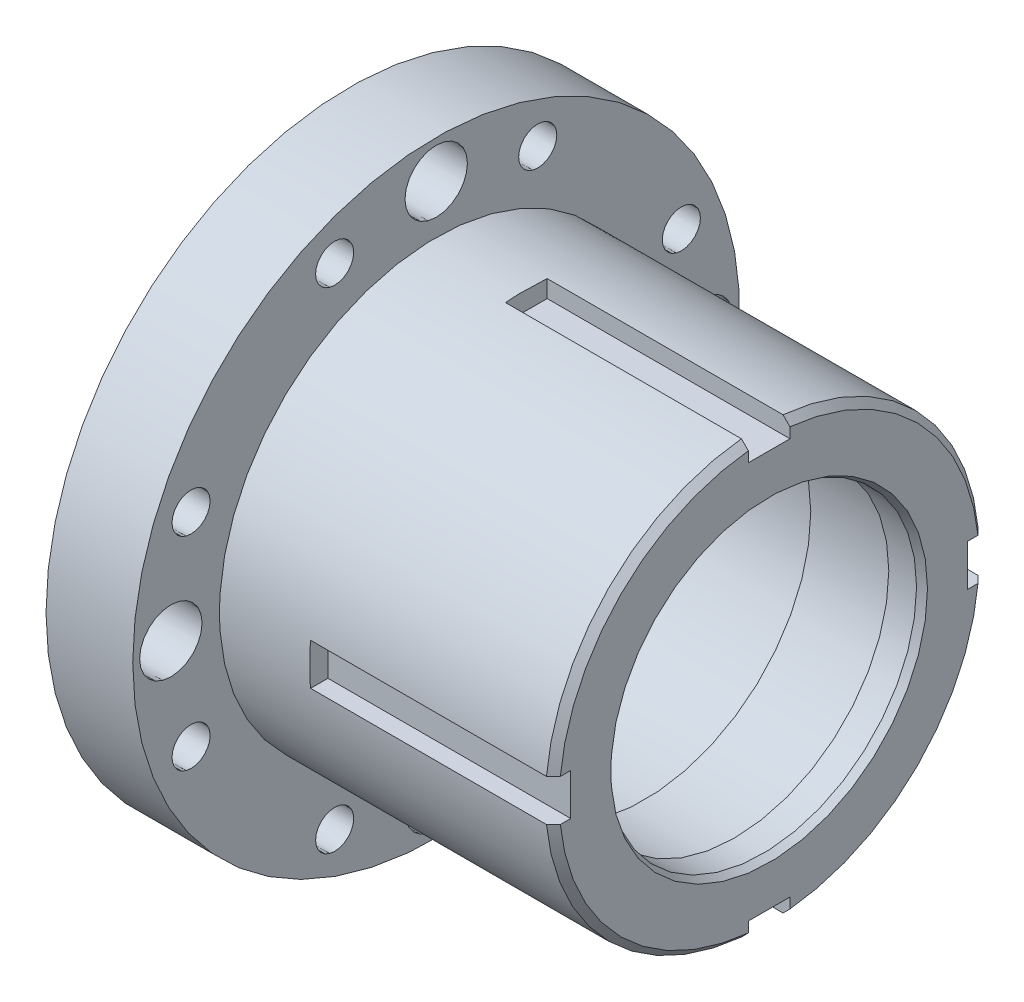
SolidWorks part; units mm, degrees
ref_plane "Plan de face" through (0, 0, 0) normal (0, 0, 1) x (1, 0, 0)
ref_plane "Plan de dessus" through (0, 0, 0) normal (0, 1, 0) x (1, 0, 0)
ref_plane "Plan de droite" through (0, 0, 0) normal (1, 0, 0) x (0, 0, -1)
sketch "Esquisse1" plane through (0, 0, 0) normal (0, 0, 1) x (1, 0, 0)
  line L0 (0, 61.7998) -> (0, 51.5)
  line L1 (1.5, 50) -> (56, 50)
  line L2 (56, 50) -> (56, 48)
  line L3 (25, 62.4996) -> (118.9998, 62.4996)
  line L4 (56, 48) -> (110.9998, 48)
  line L14 (0, 51.5) -> (1.5, 50)
  line L18 (0, 87.4999) -> (25, 87.4999)
  line L19 (2.3, 65.6998) -> (2.3, 61.7998)
  line L20 (2.3, 65.6998) -> (0, 65.6998)
  line L21 (2.3, 61.7998) -> (0, 61.7998)
  line L22 (25, 87.4999) -> (25, 62.4996)
  line L28 (120.9998, 60.4996) -> (120.9998, 45.6543)
  line L29 (110.9998, 44.4996) -> (110.9998, 48)
  line L30 (118.9998, 44.4996) -> (110.9998, 44.4996)
  line L31 (118.9998, 44.4996) -> (120.9998, 45.6543)
  line L32 (118.9998, 62.4996) -> (120.9998, 60.4996)
  line L33 (0, 87.4999) -> (0, 65.6998)
  line L42 (-102.5038, 0) -> (250.4656, 0) construction
  dimension "D1" = 54.5
  dimension "D2" = 50
revolve "Révolution1" add sketch "Esquisse1" angle 360 about L42
sketch "Esquisse3" plane through (0, 0, 0) normal (-1, 0, 0) x (0, 0, 1)
  line L0 (0, 95.6859) -> (0, 0) construction
  line L1 (0, 0) -> (-40.0963, 96.8011) construction
  line L2 (0.001, 0) -> (-29.2753, 70.6768) construction
  line L3 (0.001, 0) -> (29.2756, 70.6775) construction
  circle A0 centre (0, 0) radius 76.5 construction
  circle A1 centre (-29.2753, 70.6768) radius 5.5
  circle A2 centre (29.2756, 70.6775) radius 5.5
  dimension "D2" = 153
  dimension "D3" = 11
  dimension "D1" = 22.5
  dimension "D4" = 45
extrude "Extrusion2" cut sketch "Esquisse3" against normal blind 35
pattern_circular "Répétition circulaire1" count 4 over 360 about axis through (0, 0, 0) along (1, 0, 0) of "Extrusion2"
sketch "Esquisse4" plane through (0, 0, 0) normal (-1, 0, 0) x (0, 0, 1)
  line L0 (0, 100.9225) -> (0, 0) construction
  circle A0 centre (0, 0) radius 76.5 construction
  circle A1 centre (0, 0) radius 76.5 construction
  circle A2 centre (0, 76.5) radius 9
  circle A3 centre (76.5, 0) radius 9
  circle A4 centre (0, -76.5) radius 9
  circle A5 centre (-76.5, 0) radius 9
  dimension "D1" = 18
extrude "Extrusion3" cut sketch "Esquisse4" against normal blind 35
ref_plane "Plan1" through (0, 0, 0) normal (0, 0, -1) x (-1, 0, 0)
ref_plane "Plan2" through (71.9999, -62.4996, 0) normal (0, -1, 0) x (0, 0, 1)
sketch "Esquisse5" plane through (71.9999, -62.4996, 0) normal (0, -1, 0) x (0, 0, 1)
  line L0 (0, 82.3321) -> (0, -30.9463) construction
  line L1 (60.4996, -48.9999) -> (-60.4996, -48.9999) construction
  circle A0 centre (0, 21.0001) radius 6
  dimension "D2" = 12
  dimension "D1" = 70
extrude "Extrusion4" cut sketch "Esquisse5" against normal blind 35
sketch "Esquisse6" plane through (120.9998, 0, 0) normal (1, 0, 0) x (0, 0, -1)
  line L0 (0, 78.6389) -> (0, -25.2281) construction
  line L1 (-6, 57.2109) -> (-6, 62.2109)
  line L2 (6, 57.2109) -> (6, 62.2109)
  line L3 (-6, 57.2109) -> (6, 57.2109)
  line L4 (-6, 62.2109) -> (-6, 65.0467)
  line L5 (-6, 65.0467) -> (6, 65.0467)
  line L6 (6, 65.0467) -> (6, 62.2109)
  circle A2 centre (0, 0) radius 62.4996 construction
  dimension "D1" = 12
  dimension "D2" = 5
  dimension "D3" = 5
extrude "Extrusion5" cut sketch "Esquisse6" against normal blind 70
pattern_circular "Répétition circulaire2" count 4 over 360 about axis through (0, 0, 0) along (1, 0, 0) of "Extrusion5"
